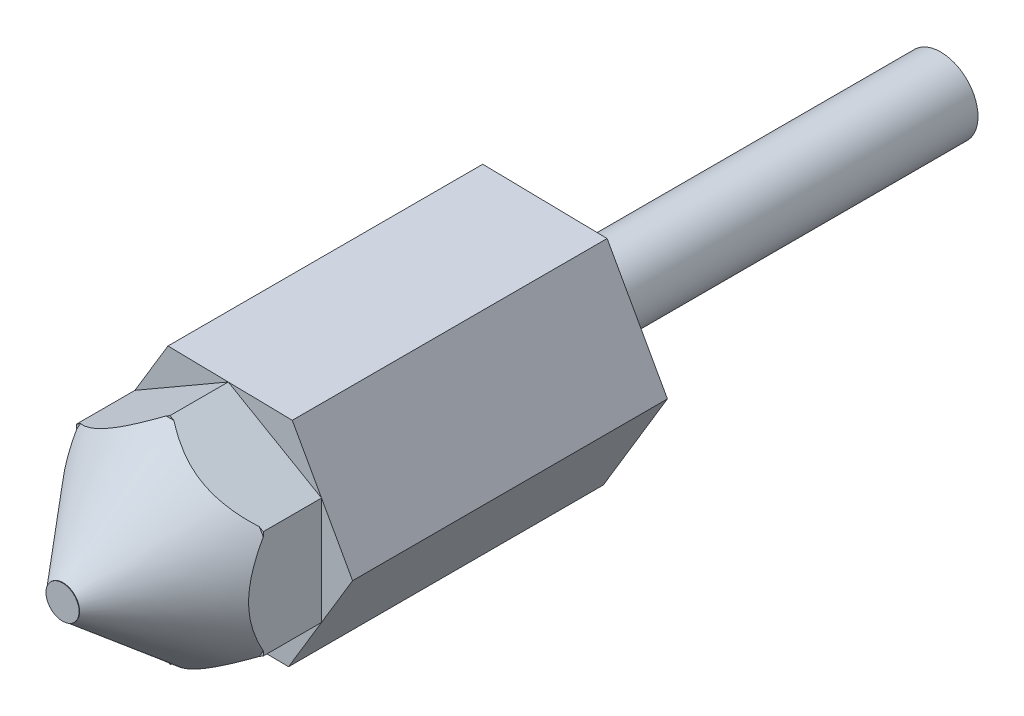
SolidWorks part; units mm, degrees
ref_plane "Alzado" through (0, 0, 0) normal (0, 0, 1) x (1, 0, 0)
ref_plane "Planta" through (0, 0, 0) normal (0, 1, 0) x (1, 0, 0)
ref_plane "Vista lateral" through (0, 0, 0) normal (1, 0, 0) x (0, 0, -1)
sketch "Croquis1" plane through (0, 0, 0) normal (0, 0, 1) x (1, 0, 0)
  line L1 (3.8663, 6.4331) -> (-3.6381, 6.5649)
  line L2 (-3.6381, 6.5649) -> (-7.5044, 0.1318)
  line L3 (-7.5044, 0.1318) -> (-3.8663, -6.4331)
  line L4 (-3.8663, -6.4331) -> (3.6381, -6.5649)
  line L5 (3.6381, -6.5649) -> (7.5044, -0.1318)
  line L6 (7.5044, -0.1318) -> (3.8663, 6.4331)
  circle A0 centre (0, 0) radius 6.5 construction
extrude "Saliente-Extruir1" add sketch "Croquis1" against normal blind 19
sketch "Croquis2" plane through (0, 0, 0) normal (0, 0, 1) x (1, 0, 0)
  line L1 (0, 6.501) -> (-5.63, 3.2505)
  line L2 (-5.63, 3.2505) -> (-5.63, -3.2505)
  line L3 (-5.63, -3.2505) -> (0, -6.501)
  line L4 (0, -6.501) -> (5.63, -3.2505)
  line L5 (5.63, -3.2505) -> (5.63, 3.2505)
  line L6 (5.63, 3.2505) -> (0, 6.501)
  circle A0 centre (0, 0) radius 5.63 construction
extrude "Saliente-Extruir2" add sketch "Croquis2" along normal blind 10
sketch3d "Croquis3D5" plane through (0, 0, 0) normal (0, 0, 1) x (1, 0, 0)
  dimension "D1" = 5.63
sketch "Croquis6" plane through (0, 0, 0) normal (-0.5, 0.866, 0) x (0.866, 0.5, 0)
  line L0 (0, -10.1559) -> (1, -10.1559) construction
  line L1 (7.7, 0) -> (7.7, -3.5157) construction
  line L2 (7.7, -3.5157) -> (6.3675, -3.5157)
  line L3 (6.3675, -3.5157) -> (1, -9.9701)
  line L4 (1, -9.9701) -> (1, -10.1559)
  line L5 (1, -10.1559) -> (7.7, -10.1559)
  line L6 (7.7, -10.1559) -> (7.7, -3.5157)
  line L7 (0, -10.1559) -> (0, -3.5157) construction
revolve "Cortar-Revolución2" cut sketch "Croquis6" angle 360 about L7
sketch "Croquis7" plane through (0, 0, -19) normal (0, 0, -1) x (-1, 0, 0)
  circle A0 centre (0, 0) radius 2.25
extrude "Saliente-Extruir3" add sketch "Croquis7" along normal blind 24
